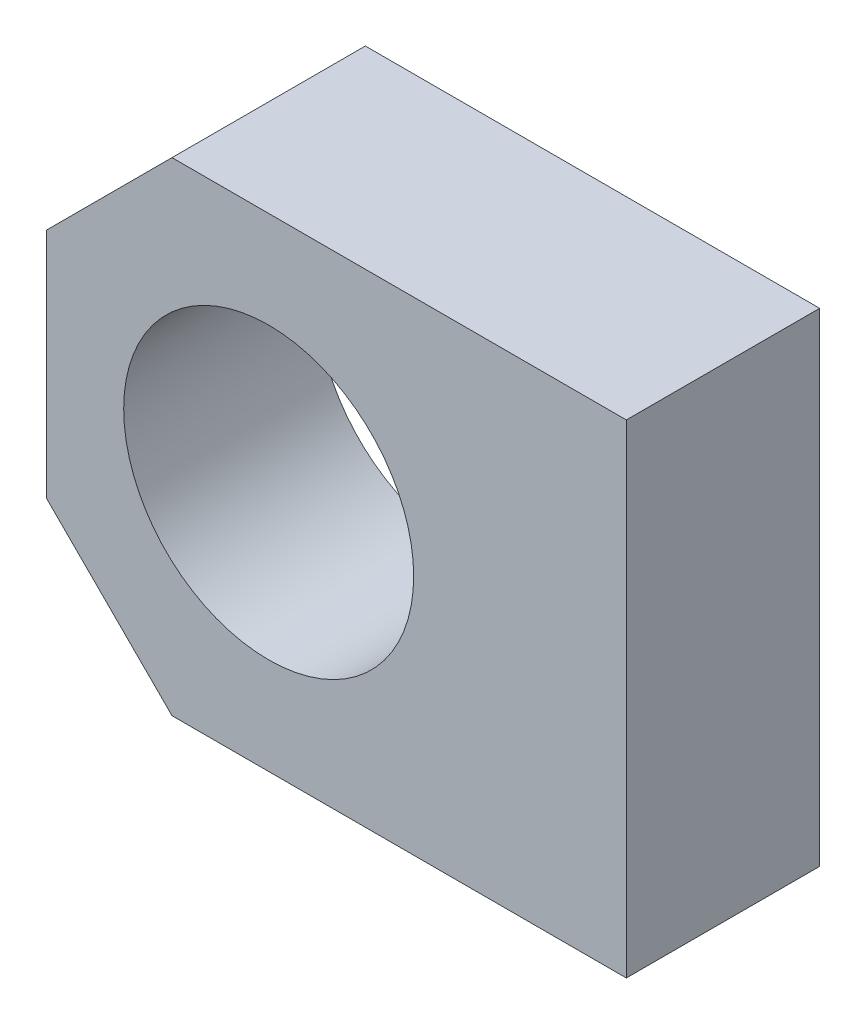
SolidWorks part; units mm, degrees
ref_plane "Plan de face" through (0, 0, 0) normal (0, 0, 1) x (1, 0, 0)
ref_plane "Plan de dessus" through (0, 0, 0) normal (0, 1, 0) x (1, 0, 0)
ref_plane "Plan de droite" through (0, 0, 0) normal (1, 0, 0) x (0, 0, -1)
sketch "Esquisse1" plane through (0, 0, 0) normal (0, 0, 1) x (1, 0, 0)
  line L0 (-60, 25) -> (-37, 25) construction
  line L1 (0, 0) -> (-60, 0)
  line L2 (0, 0) -> (0, 50)
  line L3 (0, 50) -> (-60, 50)
  line L4 (-60, 0) -> (-60, 50)
  circle A0 centre (-37, 25) radius 15
  dimension "D1" = 30
  dimension "D2" = 50
  dimension "D3" = 60
  dimension "D4" = 23
extrude "Boss.-Extru.1" add sketch "Esquisse1" along normal blind 20
chamfer "Chanfrein1" distance 13 angle 45 2 edges at (-60, 0, 10) (-60, 50, 10)
